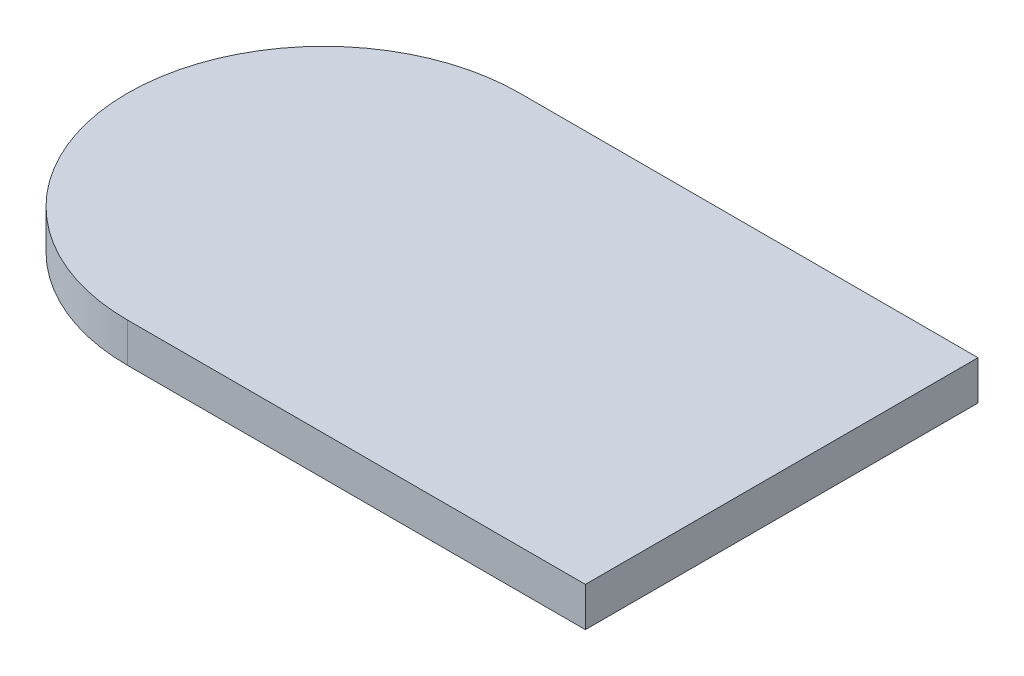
SolidWorks part; units mm, degrees
ref_plane "Front Plane" through (0, 0, 0) normal (0, 0, 1) x (1, 0, 0)
ref_plane "Top Plane" through (0, 0, 0) normal (0, 1, 0) x (1, 0, 0)
ref_plane "Right Plane" through (0, 0, 0) normal (1, 0, 0) x (0, 0, -1)
sketch "Sketch1" plane through (0, 0, 0) normal (0, 1, 0) x (1, 0, 0)
  line L1 (0, -1.5) -> (3.5, -1.5)
  line L3 (0, 1.5) -> (3.5, 1.5)
  line L4 (3.5, -1.5) -> (3.5, 1.5)
  arc A0 (0, 1.5) -> (0, -1.5) centre (0, 0) ccw
  dimension "D1" = 3.5
  dimension "D2" = 3
extrude "Boss-Extrude1" add sketch "Sketch1" along normal blind 0.3
equation "\"0.31`\"=0.1"
